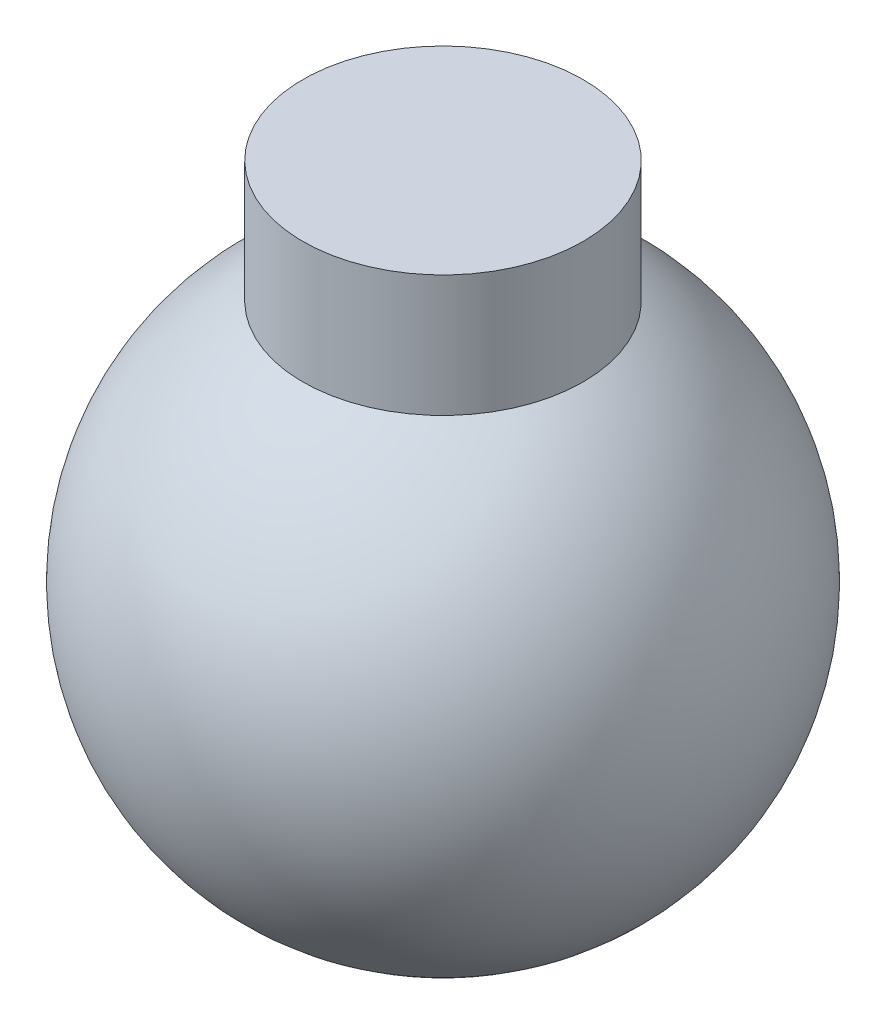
SolidWorks part; units mm, degrees
ref_plane "Front Plane" through (0, 0, 0) normal (0, 0, 1) x (1, 0, 0)
ref_plane "Top Plane" through (0, 0, 0) normal (0, 1, 0) x (1, 0, 0)
ref_plane "Right Plane" through (0, 0, 0) normal (1, 0, 0) x (0, 0, -1)
sketch "Sketch1" plane through (0, 0, 0) normal (0, 0, 1) x (1, 0, 0)
  line L0 (0, 0) -> (0, 8.7702) construction
  line L1 (0, 0) -> (0, -5) construction
  line L2 (2.5, 4.3301) -> (2.5, 6.5)
  line L3 (2.5, 6.5) -> (0, 6.5)
  line L4 (0, -5) -> (0, 6.5)
  arc A0 (0, -5) -> (2.5, 4.3301) centre (0, 0) ccw
  point P7 (0, 4.3301)
  dimension "D1" = 10
  dimension "D2" = 2.5
  dimension "D3" = 6.5
revolve "Revolve1" add sketch "Sketch1" angle 360 about L4
